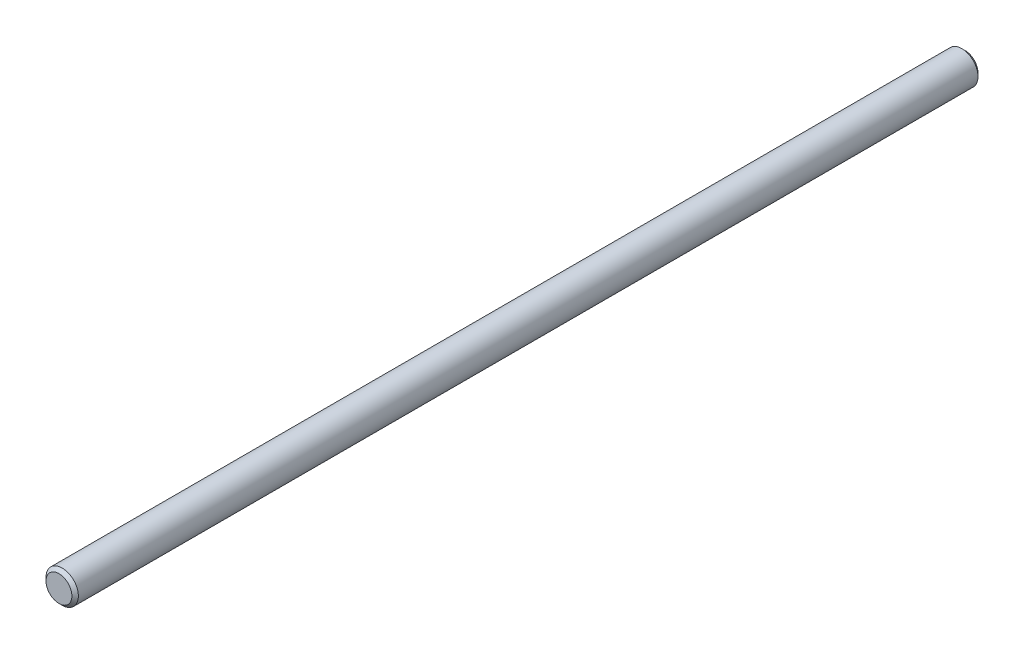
SolidWorks part; units mm, degrees
ref_plane "Face" through (0, 0, 0) normal (0, 0, 1) x (1, 0, 0)
ref_plane "Dessus" through (0, 0, 0) normal (0, 1, 0) x (1, 0, 0)
ref_plane "Droite" through (0, 0, 0) normal (1, 0, 0) x (0, 0, -1)
sketch "Esquisse1" plane through (0, 0, 0) normal (0, 0, 1) x (1, 0, 0)
  circle A0 centre (0, 0) radius 1
extrude "Base-Extrusion" add sketch "Esquisse1" along normal blind 56
chamfer "Chanfrein1" distance 0.2 angle 45 2 edges at (1, 0, 56) (1, 0, 0)
